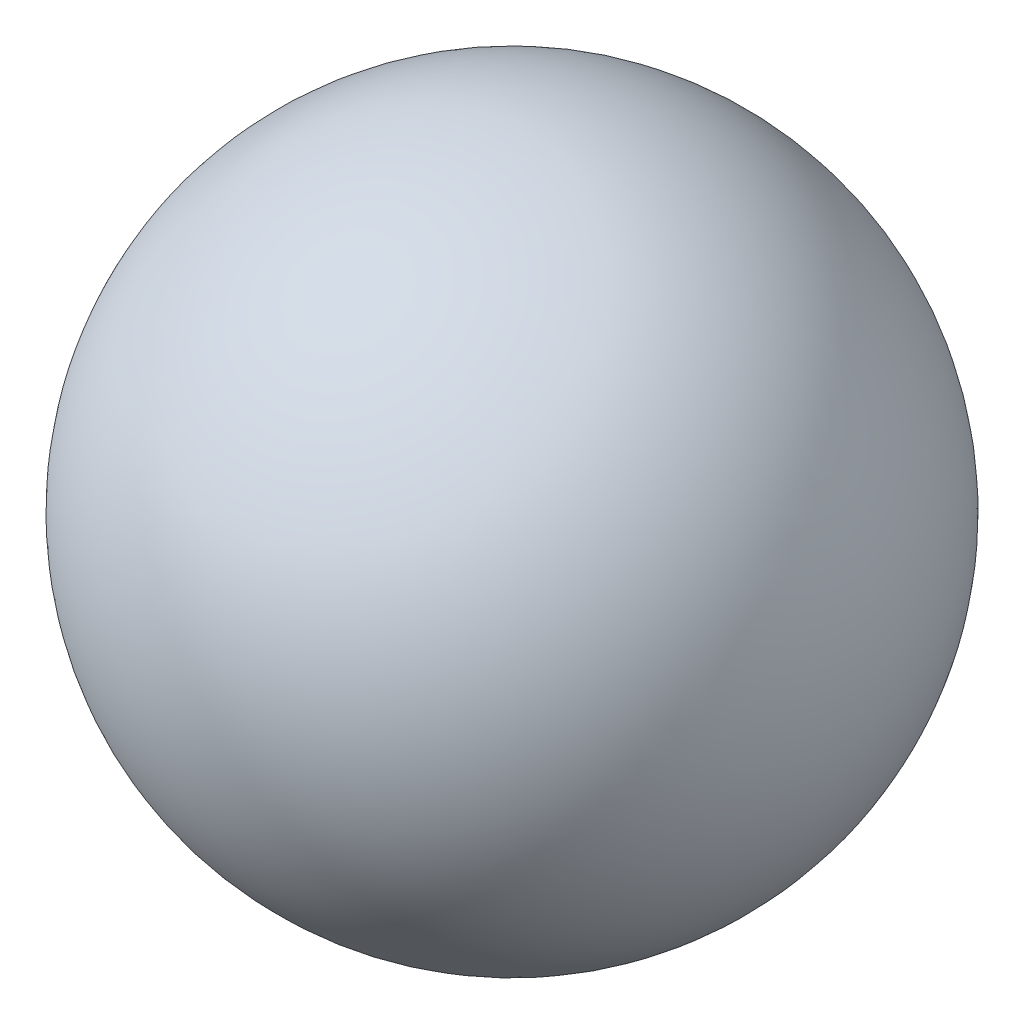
SolidWorks part; units mm, degrees
ref_plane "Plan1" through (0, 0, 0) normal (0, 0, 1) x (1, 0, 0)
ref_plane "Plan2" through (0, 0, 0) normal (0, 1, 0) x (1, 0, 0)
ref_plane "Plan3" through (0, 0, 0) normal (1, 0, 0) x (0, 0, -1)
sketch "Esquisse1" plane through (0, 0, 0) normal (0, 1, 0) x (1, 0, 0)
  line L1 (-1, 5.75) -> (14, 5.75) construction
  line L2 (-1, 11.5) -> (-1, 0) construction
  line L3 (14, 11.5) -> (14, 0) construction
  line L4 (2.45, 5.75) -> (10.55, 5.75)
  circle A1 centre (6.5, 5.75) radius 4.05 construction
  arc A2 (10.55, 5.75) -> (2.45, 5.75) centre (6.5, 5.75) ccw
revolve "Base-Révolution" add sketch "Esquisse1" angle 360 about L1
